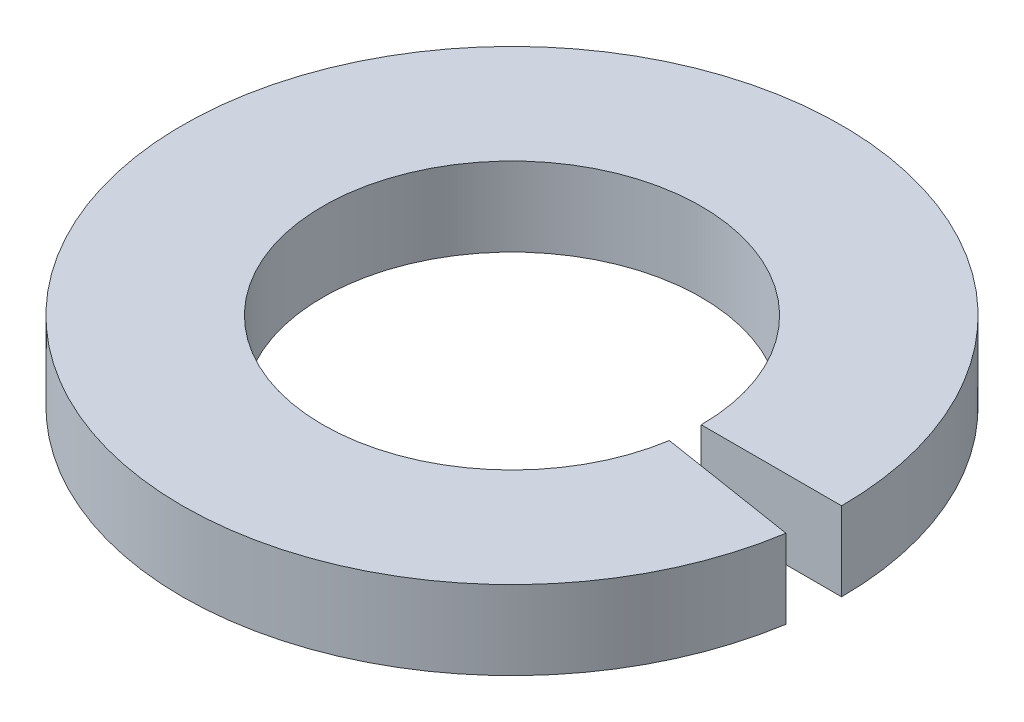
SolidWorks part; units mm, degrees
ref_plane "Front" through (0, 0, 0) normal (0, 0, 1) x (1, 0, 0)
ref_plane "Top" through (0, 0, 0) normal (0, 1, 0) x (1, 0, 0)
ref_plane "Right" through (0, 0, 0) normal (1, 0, 0) x (0, 0, -1)
sketch "Sketch1" plane through (0, 0, 0) normal (0, 0, 1) x (1, 0, 0)
  line L0 (0, -31.75) -> (0, 32.385) construction
  line L1 (1.524, 0) -> (1.524, 0.635)
  line L2 (1.524, 0.635) -> (2.6543, 0.635)
  line L3 (2.6543, 0.635) -> (2.6543, 0)
  line L4 (2.6543, 0) -> (1.524, 0)
revolve "Base-Revolve" add sketch "Sketch1" angle 351 about L0
